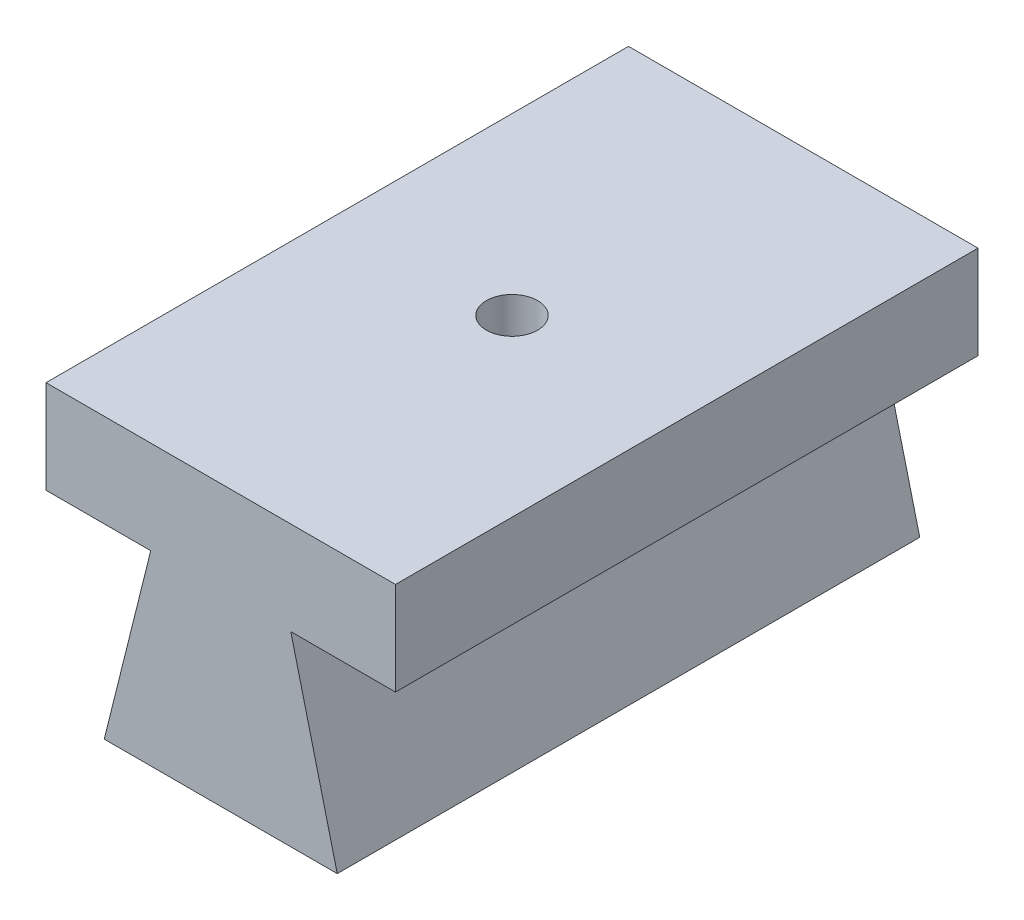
SolidWorks part; units mm, degrees
ref_plane "Front" through (0, 0, 0) normal (0, 0, 1) x (1, 0, 0)
ref_plane "Top" through (0, 0, 0) normal (0, 1, 0) x (1, 0, 0)
ref_plane "Right" through (0, 0, 0) normal (1, 0, 0) x (0, 0, -1)
other "Configuration Table"
sketch "Sketch1" plane through (0, 0, 0) normal (0, 0, 1) x (1, 0, 0)
  line L0 (0, 0) -> (0, 26.1543) construction
  line L1 (6.35, 0) -> (-6.35, 0)
  line L2 (-6.35, 0) -> (-3.8168, 10.16)
  line L3 (6.35, 0) -> (3.8168, 10.16)
  line L4 (-3.8168, 10.16) -> (-9.525, 10.16)
  line L5 (3.8168, 10.16) -> (9.525, 10.16)
  line L6 (-9.525, 10.16) -> (-9.525, 15.24)
  line L7 (9.525, 10.16) -> (9.525, 15.24)
  line L8 (-9.525, 15.24) -> (9.525, 15.24)
  point P5 (0, 0)
  point P13 (0, 15.24)
  dimension "D1" = 19.05
  dimension "D2" = 5.08
  dimension "D3" = 10.16
  dimension "D4" = 12.7
  dimension "D5" = 28
extrude "Base-Extrude" add sketch "Sketch1" along normal mid plane 31.75
sketch "Sketch3" plane through (0, 15.24, 0) normal (0, 1, 0) x (-1, 0, 0)
  circle A0 centre (0, 0) radius 1.397
  dimension "D1" = 2.794
extrude "Cut-Extrude2" cut sketch "Sketch3" against normal blind 12.7
